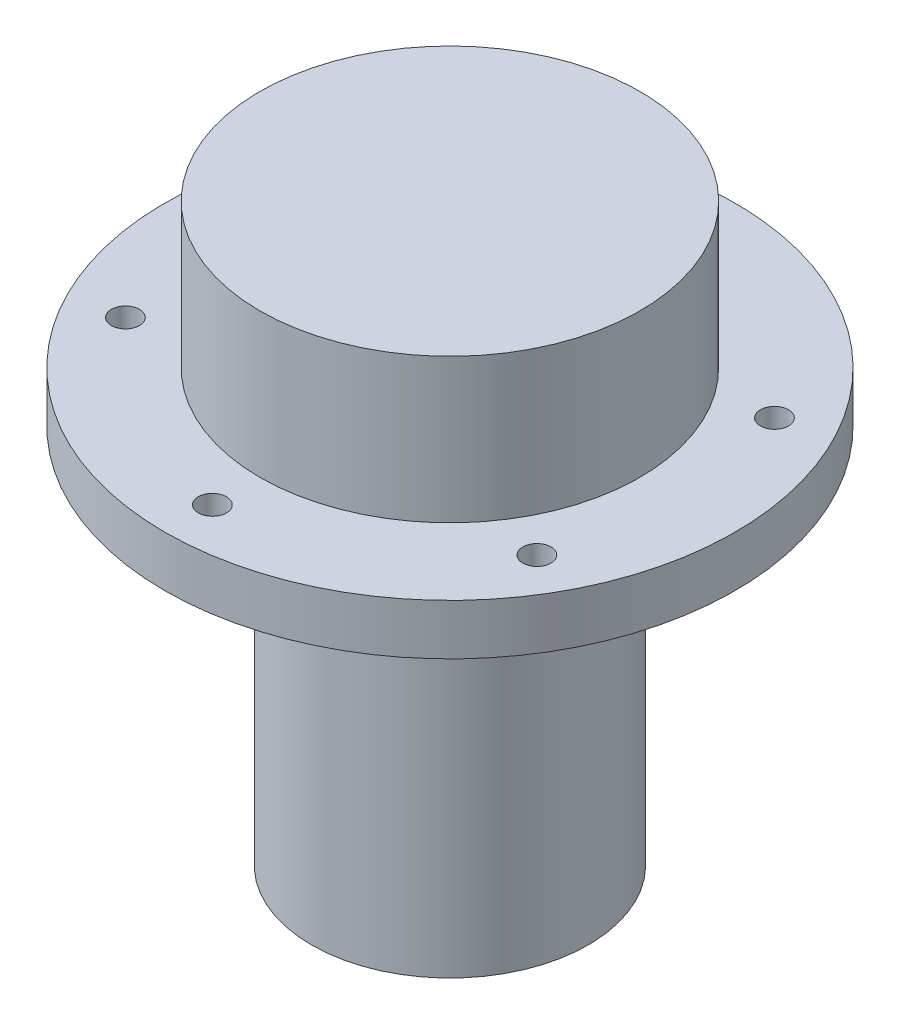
SolidWorks part; units mm, degrees
ref_plane "Front Plane" through (0, 0, 0) normal (0, 0, 1) x (1, 0, 0)
ref_plane "Top Plane" through (0, 0, 0) normal (0, 1, 0) x (1, 0, 0)
ref_plane "Right Plane" through (0, 0, 0) normal (1, 0, 0) x (0, 0, -1)
sketch "Sketch1" plane through (0, 0, 0) normal (0, 1, 0) x (1, 0, 0)
  circle A0 centre (0, 0) radius 57.15
  circle A1 centre (0, 0) radius 27.7495
  circle A2 centre (0, 0) radius 47.625 construction
  circle A3 centre (0, 47.625) radius 2.8194
  circle A4 centre (41.2445, 23.8125) radius 2.8194
  circle A5 centre (41.2445, -23.8125) radius 2.8194
  circle A6 centre (0, -47.625) radius 2.8194
  circle A7 centre (-41.2445, -23.8125) radius 2.8194
  circle A8 centre (-41.2445, 23.8125) radius 2.8194
  dimension "D1" = 5.6388
  dimension "D6" = 95.25
  dimension "D2" = 60
  dimension "D3" = 60
  dimension "D4" = 60
  dimension "D5" = 60
extrude "Flange" add sketch "Sketch1" along normal blind 10.16
sketch "Sketch2" plane through (0, 0, 0) normal (0, 1, 0) x (1, 0, 0)
  circle A0 centre (0, 0) radius 27.7495
extrude "Float" add sketch "Sketch2" against normal blind 76.2 separate body
sketch "Sketch3" plane through (0, 10.16, 0) normal (0, 1, 0) x (1, 0, 0)
  circle A0 centre (0, 0) radius 38.1
extrude "Cap" add sketch "Sketch3" along normal blind 28.9052
